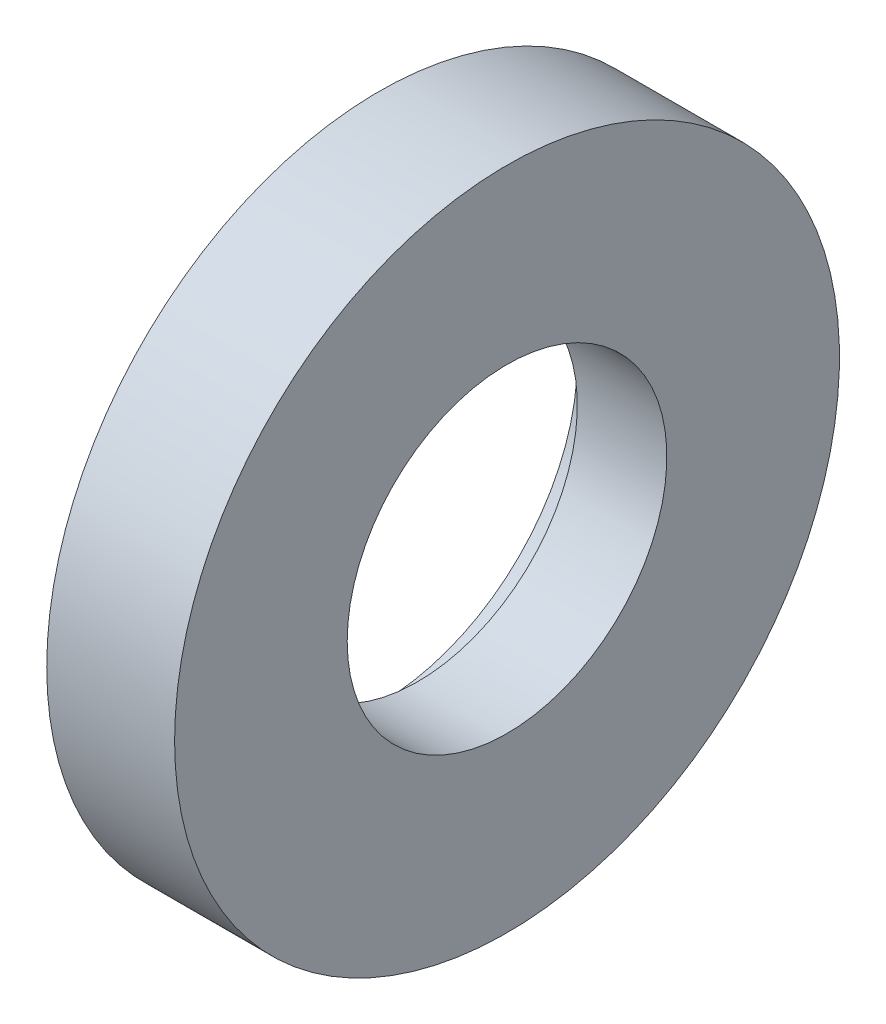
SolidWorks part; units mm, degrees
ref_plane "Plan de face" through (0, 0, 0) normal (0, 0, 1) x (1, 0, 0)
ref_plane "Plan de dessus" through (0, 0, 0) normal (0, 1, 0) x (1, 0, 0)
ref_plane "Plan de droite" through (0, 0, 0) normal (1, 0, 0) x (0, 0, -1)
sketch "Esquisse1" plane through (0, 0, 0) normal (0, 0, 1) x (1, 0, 0)
  line L0 (-24.1491, 0) -> (29.5556, 0) construction
  line L1 (0, 15.5) -> (0, 26)
  line L2 (0, 26) -> (10, 26)
  line L3 (10, 26) -> (10, 12.5)
  line L4 (10, 12.5) -> (3, 12.5)
  line L5 (3, 12.5) -> (3, 15.5)
  line L6 (3, 15.5) -> (0, 15.5)
  dimension "D1" = 25
  dimension "D2" = 31
  dimension "D3" = 52
  dimension "D4" = 3
  dimension "D5" = 10
revolve "Révolution1" add sketch "Esquisse1" angle 360 about L0
